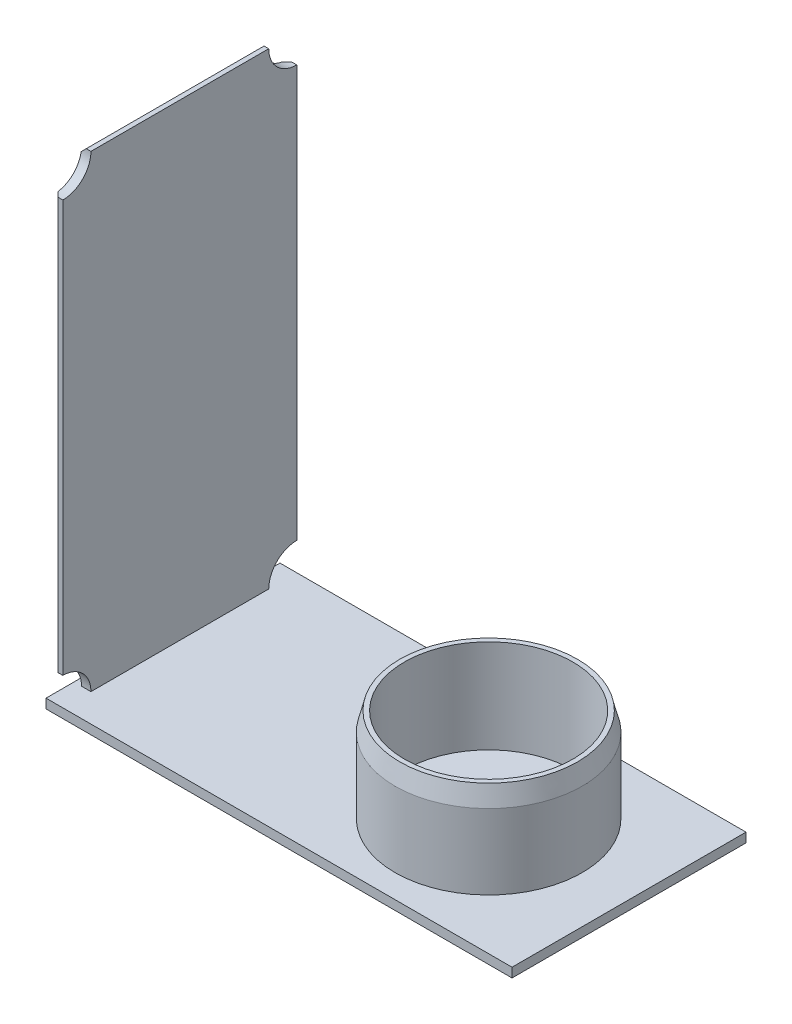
SolidWorks part; units mm, degrees
ref_plane "Ebene vorne" through (0, 0, 0) normal (0, 0, 1) x (1, 0, 0)
ref_plane "Ebene oben" through (0, 0, 0) normal (0, 1, 0) x (1, 0, 0)
ref_plane "Ebene rechts" through (0, 0, 0) normal (1, 0, 0) x (0, 0, -1)
other "Vereinigen1"
other "Teil3<1>@BG-Test"
other "BG-Test<1>@BG-Test"
other "Teil2<1>@BG-Test"
chamfer "Fase1" distance 5 angle 45 3 edges at (-240, 255, -125) (-240, 505, 0) (-240, 255, 125)
sketch "Skizze2" plane through (-250, 0, 0) normal (-1, 0, 0) x (0, 0, 1)
  line L4 (-125, -5) -> (125, -5)
  line L5 (125, -5) -> (125, 5)
  line L6 (125, 5) -> (-125, 5)
  line L7 (-125, 5) -> (-125, -5)
  line L8 (-125, -5) -> (125, -5)
  line L9 (125, -5) -> (125, 5)
  line L10 (125, 5) -> (-125, 5)
  line L11 (-125, 5) -> (-125, -5)
  dimension "D1" = 0
extrude "Schnitt-Linear austragen1" cut sketch "Skizze2" against normal blind 2
chamfer "Fase2" distance 20 distance2 5 1 edges at (100, 105, 100)
